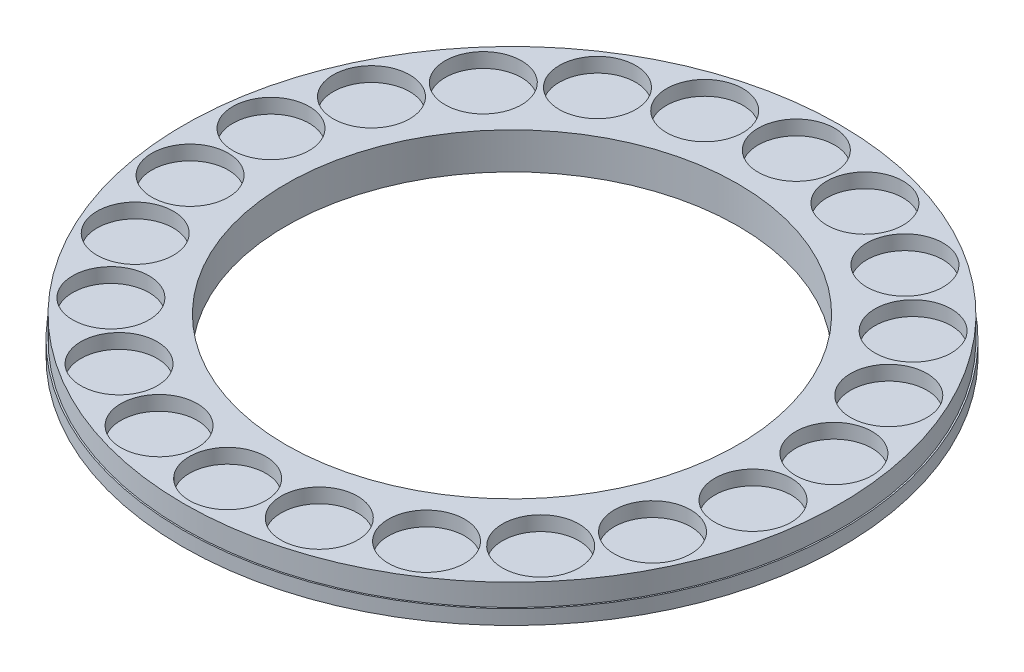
SolidWorks part; units mm, degrees
ref_plane "Front" through (0, 0, 0) normal (0, 0, 1) x (1, 0, 0)
ref_plane "Top" through (0, 0, 0) normal (0, 1, 0) x (1, 0, 0)
ref_plane "Right" through (0, 0, 0) normal (1, 0, 0) x (0, 0, -1)
sketch "Sketch1" plane through (0, 0, 0) normal (0, 1, 0) x (1, 0, 0)
  circle A0 centre (0, 0) radius 285.75
  dimension "D1" = 571.5
extrude "Extrude1" add sketch "Sketch1" along normal blind 19.05
sketch "Sketch2" plane through (0, 0, 0) normal (0, -1, 0) x (1, 0, 0)
  circle A0 centre (0, 0) radius 287.02
  dimension "D1" = 574.04
extrude "Extrude2" add sketch "Sketch2" along normal blind 12.7
sketch "Sketch3" plane through (0, 19.05, 0) normal (0, 1, 0) x (-1, 0, 0)
  line L0 (0, 0) -> (0, 365.6483) construction
  circle A0 centre (0, 247.65) radius 33.274
  dimension "D1" = 66.548
  dimension "D2" = 247.65
extrude "Cut-Extrude1" cut sketch "Sketch3" against normal blind 12.7
pattern_circular "CirPattern1" count 22 over 360 about axis through (0, 0, 0) along (0, 1, 0) of "Cut-Extrude1"
sketch "Sketch6" plane through (0, 19.05, 0) normal (0, 1, 0) x (-1, 0, 0)
  circle A0 centre (0, 0) radius 196.85
  dimension "D1" = 393.7
extrude "Cut-Extrude5" cut sketch "Sketch6" against normal through all
